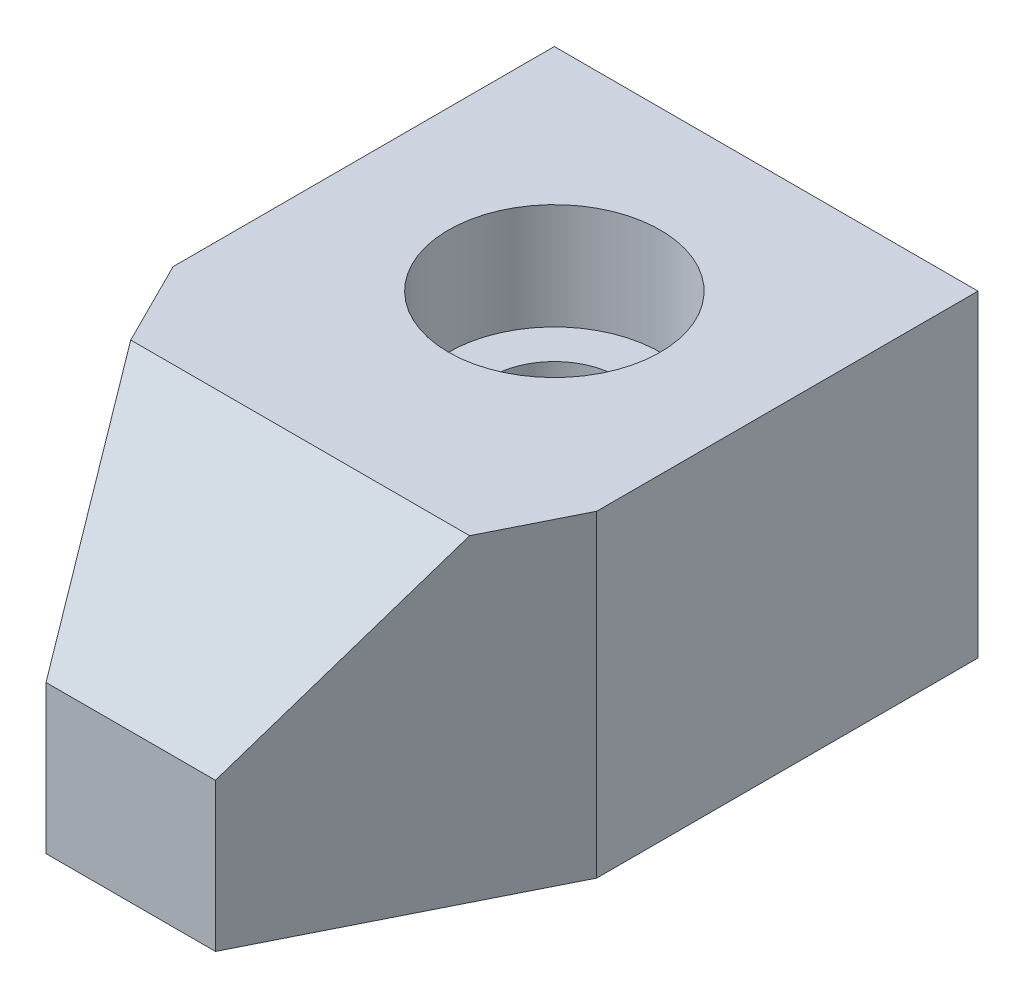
SolidWorks part; units mm, degrees
ref_plane "前视基准面" through (0, 0, 0) normal (0, 0, 1) x (1, 0, 0)
ref_plane "上视基准面" through (0, 0, 0) normal (0, 1, 0) x (1, 0, 0)
ref_plane "右视基准面" through (0, 0, 0) normal (1, 0, 0) x (0, 0, -1)
sketch "草图1" plane through (0, 0, 0) normal (1, 0, 0) x (0, 0, -1)
  line L1 (-15, -7.5) -> (15, -7.5)
  line L2 (-15, -7.5) -> (-15, 7.5)
  line L3 (-15, 7.5) -> (15, 7.5)
  line L4 (15, -7.5) -> (15, 7.5)
  line L5 (-15, -7.5) -> (15, 7.5) construction
  line L6 (-15, 7.5) -> (15, -7.5) construction
  point P0 (0, 0)
  dimension "D1" = 30
  dimension "D2" = 15
extrude "凸台-拉伸1" add sketch "草图1" along normal blind 20
ref_plane "基准面1" through (10, 0, 0) normal (1, 0, 0) x (0, 0, -1)
sketch "草图3" plane through (10, 0, 0) normal (1, 0, 0) x (0, 0, -1)
  line L0 (5, 10.1511) -> (5, -11.1683) construction
  line L1 (5, 7.5232) -> (0, 7.5)
  line L2 (15, 7.5) -> (-15, 7.5) construction
  line L3 (0, 7.5) -> (0, 2.5)
  line L4 (0, 2.5) -> (2, 2.5)
  line L5 (2, 2.5) -> (2, -7.5)
  line L6 (-15, -7.5) -> (15, -7.5) construction
  line L7 (2, -7.5) -> (5, -7.5)
  line L8 (5, -7.5) -> (5, 7.5232)
  dimension "D1" = 5
  dimension "D2" = 3
  dimension "D3" = 5
  dimension "D4" = 10
revolve "切除-旋转1" cut sketch "草图3" angle 360 about L0
sketch "草图4" plane through (20, 0, 0) normal (1, 0, 0) x (0, 0, -1)
  line L0 (-15, 7.5) -> (-15, -7.5) construction
  line L1 (-15, 7.5) -> (-15, -0.5)
  line L2 (-15, -0.5) -> (-7, 7.5)
  line L3 (15, 7.5) -> (-15, 7.5) construction
  line L4 (-7, 7.5) -> (-15, 7.5)
  dimension "D1" = 8
  dimension "D2" = 8
extrude "切除-拉伸1" cut sketch "草图4" against normal blind 20
sketch "草图5" plane through (0, 0, 0) normal (0, 1, 0) x (1, 0, 0)
  line L0 (10, -1.9696) -> (10, -17.0285) construction
  line L1 (0, -3) -> (6, -15)
  line L2 (0, 15) -> (0, -7) construction
  line L3 (0, -15) -> (20, -15) construction
  line L4 (6, -15) -> (0, -15)
  line L5 (0, -15) -> (0, -3)
  line L6 (14, -15) -> (20, -15)
  line L7 (20, -15) -> (20, -3)
  line L8 (20, -3) -> (14, -15)
  dimension "D1" = 6
  dimension "D2" = 12
extrude "切除-拉伸2" cut sketch "草图5" against normal mid plane 20
